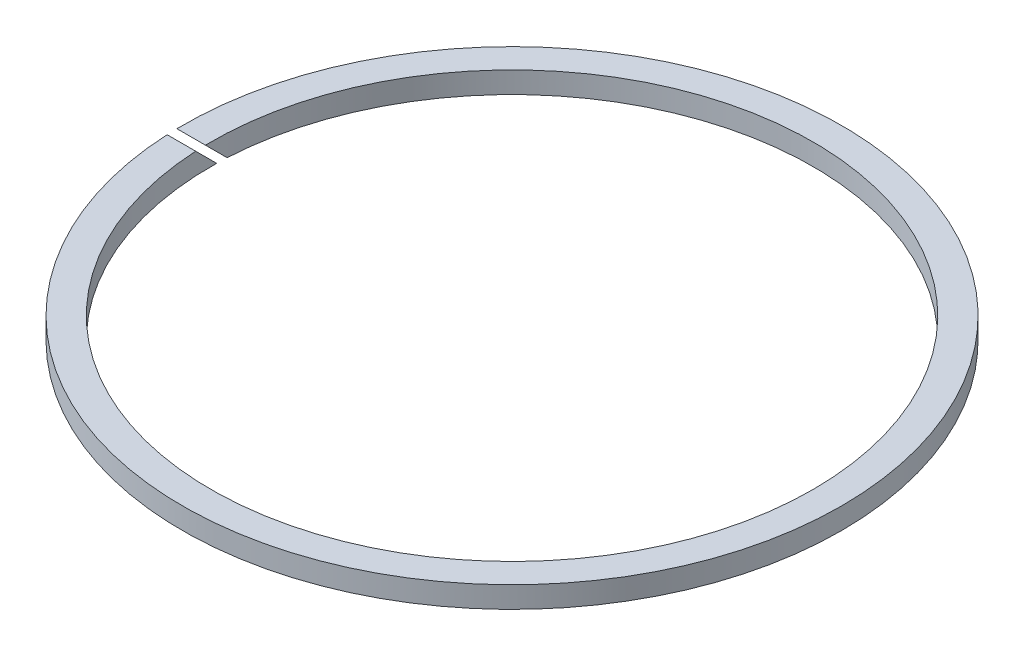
SolidWorks part; units mm, degrees
ref_plane "Front Plane" through (0, 0, 0) normal (0, 0, 1) x (1, 0, 0)
ref_plane "Top Plane" through (0, 0, 0) normal (0, 1, 0) x (1, 0, 0)
ref_plane "Right Plane" through (0, 0, 0) normal (1, 0, 0) x (0, 0, -1)
sketch "Sketch1" plane through (0, 0, 0) normal (0, 1, 0) x (1, 0, 0)
  circle A0 centre (0, 0) radius 42.25
  circle A1 centre (0, 0) radius 46.25
  dimension "D1" = 84.5
  dimension "D2" = 92.5
extrude "Boss-Extrude1" add sketch "Sketch1" along normal mid plane 3
sketch "Sketch2" plane through (0, 0, 0) normal (1, 0, 0) x (0, 0, -1)
  line L0 (-3.6729, 4.38) -> (4.38, -3.6729)
  line L1 (-3.6729, 4.38) -> (-4.38, 3.6729)
  line L2 (4.38, -3.6729) -> (3.6729, -4.38)
  line L3 (-4.38, 3.6729) -> (3.6729, -4.38)
  line L4 (-3.6729, 4.38) -> (3.6729, -4.38) construction
  line L5 (4.38, -3.6729) -> (-4.38, 3.6729) construction
  line L6 (0, 0) -> (9.7958, 0) construction
  point P1 (0, 0)
  dimension "D1" = 45
  dimension "D2" = 1
extrude "Cut-Extrude1" cut sketch "Sketch2" against normal up to next
